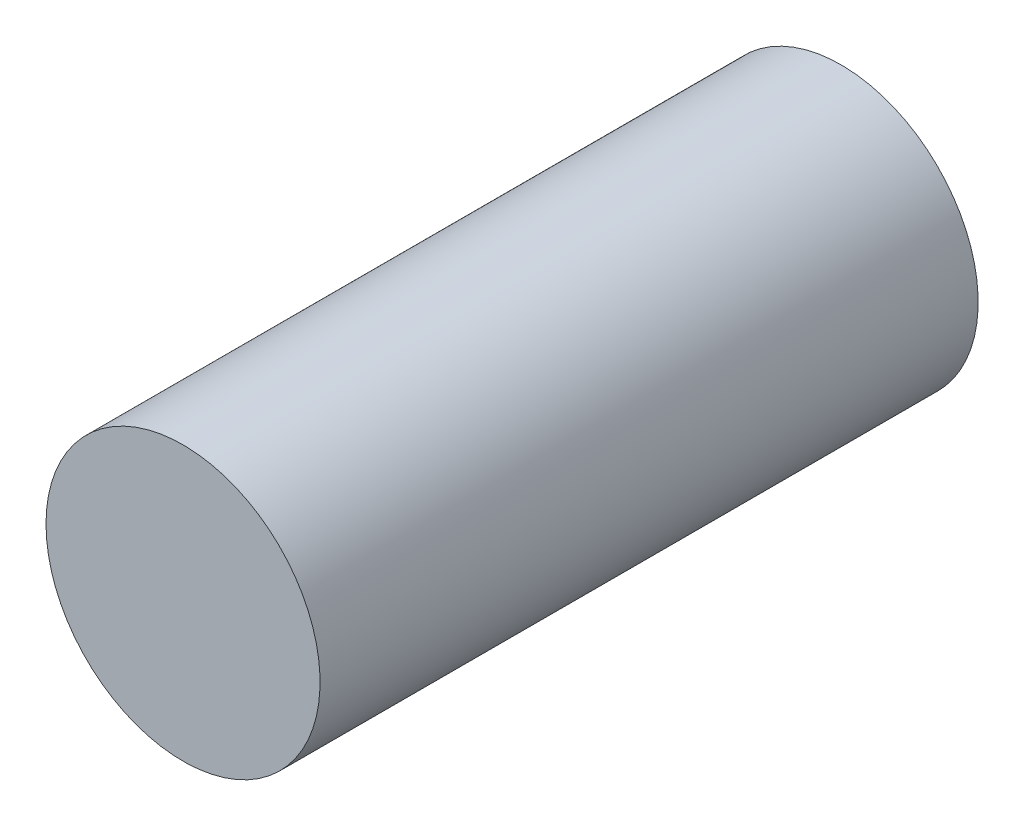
SolidWorks part; units mm, degrees
ref_plane "Front Plane" through (0, 0, 0) normal (0, 0, 1) x (1, 0, 0)
ref_plane "Top Plane" through (0, 0, 0) normal (0, 1, 0) x (1, 0, 0)
ref_plane "Right Plane" through (0, 0, 0) normal (1, 0, 0) x (0, 0, -1)
sketch "Sketch1" plane through (0, 0, 0) normal (0, 0, 1) x (1, 0, 0)
  circle A0 centre (0, 0) radius 73.5135
extrude "Boss-Extrude1" add sketch "Sketch1" along normal blind 353.06
ref_plane "Plane1" through (0, -101.6, 0) normal (0, 1, 0) x (1, 0, 0)
sketch "Sketch2" plane through (0, -101.6, 0) normal (0, 1, 0) x (1, 0, 0)
  line L0 (-80.257, -178.2549) -> (87.3543, -178.2549) construction
  text T0 "SolidProfessor" font "Century Gothic" height in points 48
